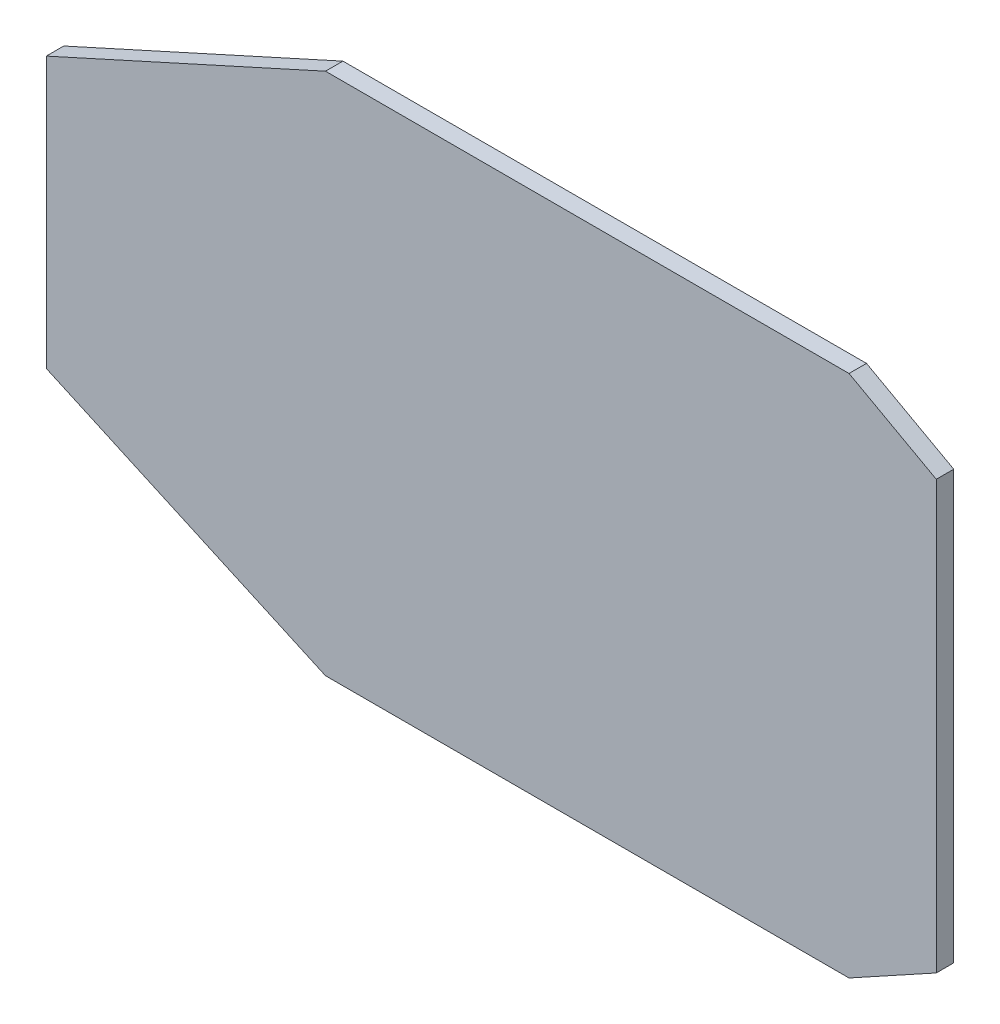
SolidWorks part; units mm, degrees
ref_plane "Plan de face" through (0, 0, 0) normal (0, 0, 1) x (1, 0, 0)
ref_plane "Plan de dessus" through (0, 0, 0) normal (0, 1, 0) x (1, 0, 0)
ref_plane "Plan de droite" through (0, 0, 0) normal (1, 0, 0) x (0, 0, -1)
sketch "Esquisse1" plane through (0, 0, 0) normal (0, 0, 1) x (1, 0, 0)
  line L1 (0, 0) -> (510, 0)
  line L2 (0, 0) -> (0, 300)
  line L3 (0, 300) -> (510, 300)
  line L4 (510, 0) -> (510, 300)
  dimension "D1" = 510
  dimension "D2" = 300
extrude "Extrusion1" add sketch "Esquisse1" along normal blind 10
chamfer "Chanfrein1" distance 27.5 distance2 50 1 edges at (510, 300, 5)
chamfer "Chanfrein2" distance 50 distance2 27.5 1 edges at (510, 0, 5)
chamfer "Chanfrein3" distance 160 distance2 72.5 1 edges at (0, 300, 5)
chamfer "Chanfrein4" distance 72.5 distance2 160 1 edges at (0, 0, 5)
